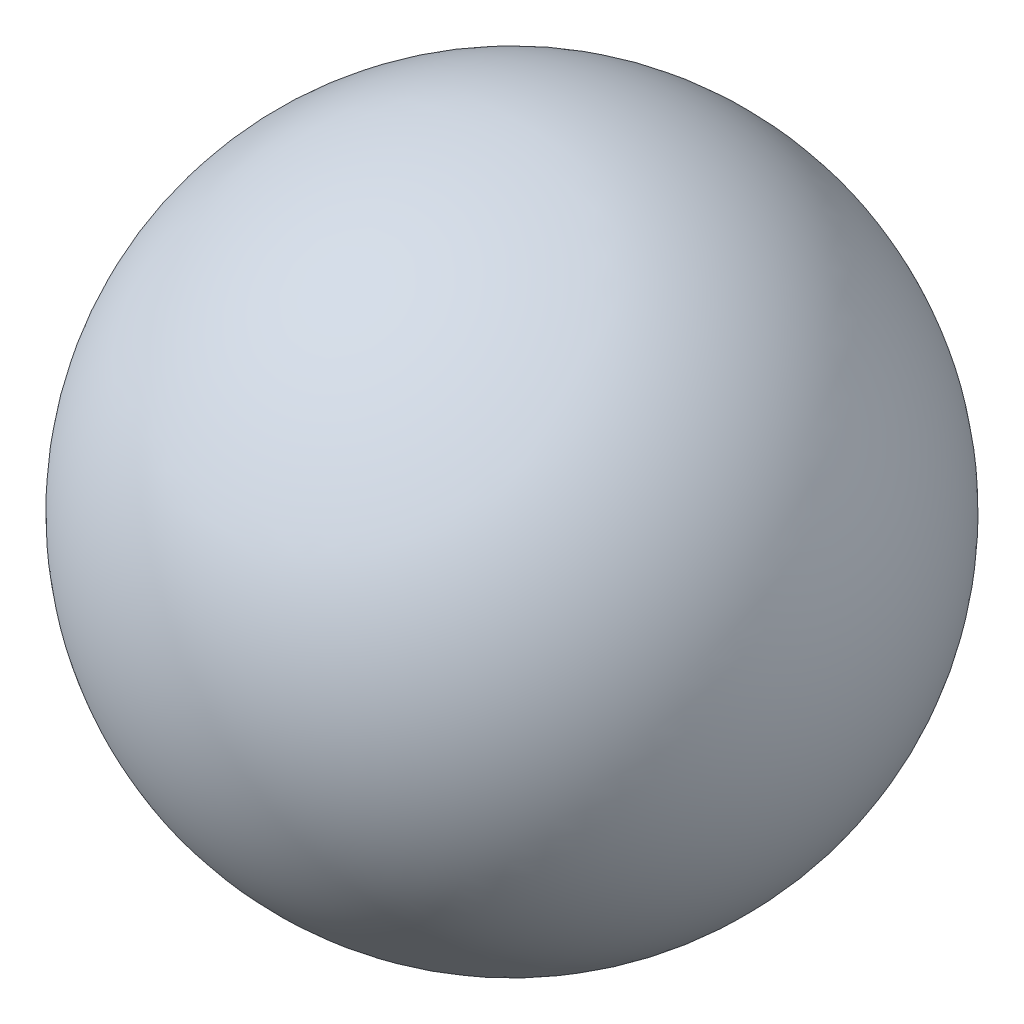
SolidWorks part; units mm, degrees
ref_plane "Front" through (0, 0, 0) normal (0, 0, 1) x (1, 0, 0)
ref_plane "Top" through (0, 0, 0) normal (0, 1, 0) x (1, 0, 0)
ref_plane "Right" through (0, 0, 0) normal (1, 0, 0) x (0, 0, -1)
sketch "Sketch2" plane through (0, 0, 0) normal (0, 1, 0) x (1, 0, 0)
  line L0 (0, 28.8551) -> (0, -24.7669) construction
  line L1 (0, 3.9624) -> (0, -3.9624)
  arc A0 (0, 3.9624) -> (0, -3.9624) centre (0, 0) cw
  dimension "D1" = 3.9624
revolve "Revolve1" add sketch "Sketch2" angle 360 about L0
